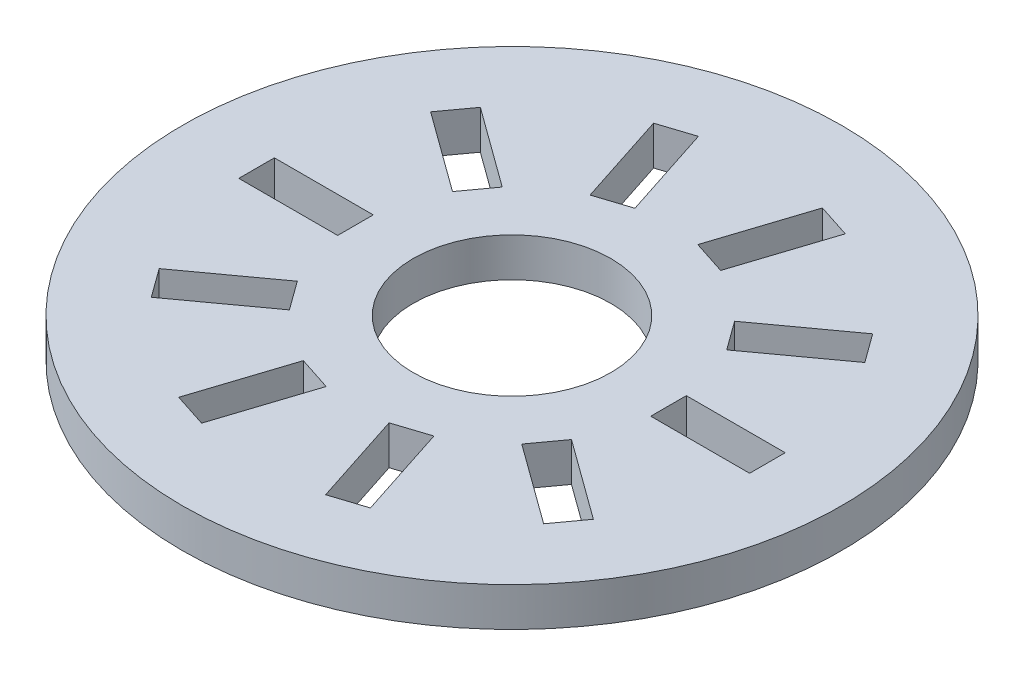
SolidWorks part; units mm, degrees
ref_plane "Front Plane" through (0, 0, 0) normal (0, 0, 1) x (1, 0, 0)
ref_plane "Top Plane" through (0, 0, 0) normal (0, 1, 0) x (1, 0, 0)
ref_plane "Right Plane" through (0, 0, 0) normal (1, 0, 0) x (0, 0, -1)
sketch "Sketch1" plane through (0, 0, 0) normal (0, 1, 0) x (1, 0, 0)
  line L0 (6.35, 0) -> (25.4, 0) construction
  line L1 (10.567, -5.982) -> (16.7317, -10.4609)
  line L2 (12.065, -1.3716) -> (19.685, -1.3716)
  line L3 (12.065, -1.3716) -> (12.065, 1.3716)
  line L4 (12.065, 1.3716) -> (19.685, 1.3716)
  line L5 (19.685, -1.3716) -> (19.685, 1.3716)
  line L6 (12.065, -1.3716) -> (19.685, 1.3716) construction
  line L7 (12.065, 1.3716) -> (19.685, -1.3716) construction
  line L8 (8.9546, -8.2013) -> (10.567, -5.982)
  line L9 (8.9546, -8.2013) -> (15.1193, -12.6802)
  line L10 (15.1193, -12.6802) -> (16.7317, -10.4609)
  line L11 (5.0328, -11.0506) -> (7.3875, -18.2977)
  line L12 (2.4238, -11.8983) -> (5.0328, -11.0506)
  line L13 (2.4238, -11.8983) -> (4.7785, -19.1454)
  line L14 (4.7785, -19.1454) -> (7.3875, -18.2977)
  line L15 (-2.4238, -11.8983) -> (-4.7785, -19.1454)
  line L16 (-5.0328, -11.0506) -> (-2.4238, -11.8983)
  line L17 (-5.0328, -11.0506) -> (-7.3875, -18.2977)
  line L18 (-7.3875, -18.2977) -> (-4.7785, -19.1454)
  line L19 (-8.9546, -8.2013) -> (-15.1193, -12.6802)
  line L20 (-10.567, -5.982) -> (-8.9546, -8.2013)
  line L21 (-10.567, -5.982) -> (-16.7317, -10.4609)
  line L22 (-16.7317, -10.4609) -> (-15.1193, -12.6802)
  line L23 (-12.065, -1.3716) -> (-19.685, -1.3716)
  line L24 (-12.065, 1.3716) -> (-12.065, -1.3716)
  line L25 (-12.065, 1.3716) -> (-19.685, 1.3716)
  line L26 (-19.685, 1.3716) -> (-19.685, -1.3716)
  line L27 (-10.567, 5.982) -> (-16.7317, 10.4609)
  line L28 (-8.9546, 8.2013) -> (-10.567, 5.982)
  line L29 (-8.9546, 8.2013) -> (-15.1193, 12.6802)
  line L30 (-15.1193, 12.6802) -> (-16.7317, 10.4609)
  line L31 (-5.0328, 11.0506) -> (-7.3875, 18.2977)
  line L32 (-2.4238, 11.8983) -> (-5.0328, 11.0506)
  line L33 (-2.4238, 11.8983) -> (-4.7785, 19.1454)
  line L34 (-4.7785, 19.1454) -> (-7.3875, 18.2977)
  line L35 (2.4238, 11.8983) -> (4.7785, 19.1454)
  line L36 (5.0328, 11.0506) -> (2.4238, 11.8983)
  line L37 (5.0328, 11.0506) -> (7.3875, 18.2977)
  line L38 (7.3875, 18.2977) -> (4.7785, 19.1454)
  line L39 (8.9546, 8.2013) -> (15.1193, 12.6802)
  line L40 (10.567, 5.982) -> (8.9546, 8.2013)
  line L41 (10.567, 5.982) -> (16.7317, 10.4609)
  line L42 (16.7317, 10.4609) -> (15.1193, 12.6802)
  circle A0 centre (0, 0) radius 25.4
  circle A1 centre (0, 0) radius 25.4 construction
  circle A2 centre (0, 0) radius 7.62
  point P5 (15.875, 0)
  point P48 (0, 0)
  dimension "D1" = 50.8
  dimension "D2" = 15.24
extrude "Boss-Extrude1" add sketch "Sketch1" along normal blind 2.9972
